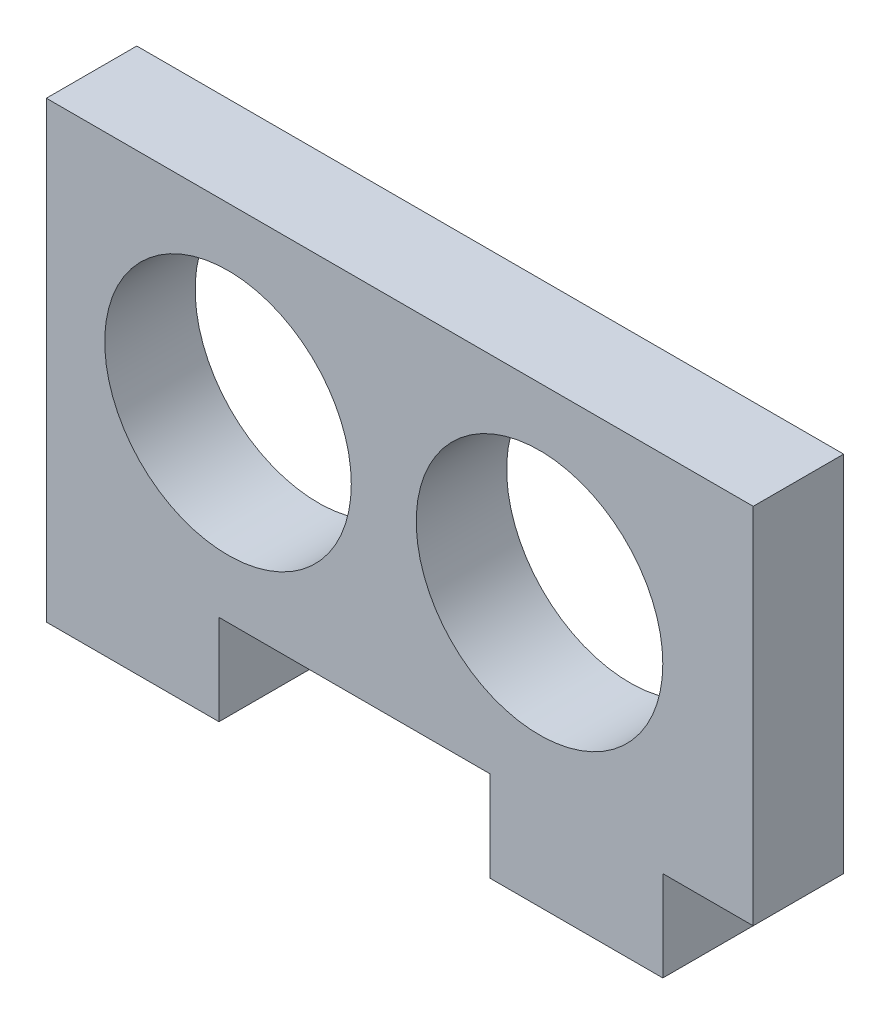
SolidWorks part; units mm, degrees
ref_plane "Front Plane" through (0, 0, 0) normal (0, 0, 1) x (1, 0, 0)
ref_plane "Top Plane" through (0, 0, 0) normal (0, 1, 0) x (1, 0, 0)
ref_plane "Right Plane" through (0, 0, 0) normal (1, 0, 0) x (0, 0, -1)
sketch "Sketch2" plane through (0, 0, 0) normal (0, 0, 1) x (1, 0, 0)
  line L0 (0, 0) -> (-37.3813, 0) construction
  line L1 (-37.3813, 0) -> (-37.3813, 5.5) construction
  line L2 (-37.3813, 5.5) -> (-0.0007, 5.5) construction
  line L4 (-37.3813, 5.5) -> (-37.3813, 27.6) construction
  line L5 (-37.3813, 27.6) -> (0.1187, 27.6) construction
  line L6 (0.1187, 27.6) -> (0.1187, 5.5) construction
  line L7 (0.1187, 5.5) -> (5.6187, 5.5) construction
  line L8 (5.6187, 5.5) -> (5.6187, 27.6) construction
  line L9 (5.6187, 27.6) -> (0.1187, 27.6) construction
  line L10 (-37.3813, 0) -> (-26.8813, 0) construction
  line L11 (0.1187, 27.6) -> (-14.8813, 27.6) construction
  line L12 (-37.3813, 27.6) -> (-15.2813, 27.6) construction
  line L13 (-15.2813, 27.6) -> (-15.2813, 5.5) construction
  line L14 (-14.8813, 27.6) -> (-14.8813, 5.5) construction
  line L15 (-14.8813, 16.55) -> (0.1187, 16.55) construction
  line L16 (-37.3813, 27.6) -> (-15.2813, 5.5) construction
  line L17 (-37.3813, 5.5) -> (-15.2813, 27.6) construction
  line L18 (-26.8813, 0) -> (-26.8813, 5.5) construction
  line L19 (0, 0) -> (-10.3813, 0) construction
  line L20 (-10.3813, 0) -> (-10.3813, 5.5) construction
  line L21 (-37.3813, 27.6) -> (0.1187, 27.6)
  line L22 (-37.3813, 27.6) -> (-37.3813, 0)
  line L23 (-37.3813, 0) -> (-26.8813, 0)
  line L24 (-26.8813, 0) -> (-26.8813, 5.5)
  line L25 (-26.8813, 5.5) -> (-10.3813, 5.5)
  line L26 (-10.3813, 5.5) -> (-10.3813, 0)
  line L27 (-10.3813, 0) -> (0, 0)
  line L29 (5.6187, 13.3165) -> (5.6187, 19.7835)
  line L31 (0.1187, 27.6) -> (5.6187, 27.6)
  line L32 (5.6187, 27.6) -> (5.6187, 19.7835)
  line L33 (5.6187, 13.3165) -> (5.6187, 5.5)
  line L34 (5.6187, 5.5) -> (0.1187, 5.5)
  line L37 (0.1187, 5.5) -> (0.1187, 0)
  line L38 (0.1187, 0) -> (0, 0)
  circle A1 centre (-7.3813, 16.55) radius 7.5
  circle A2 centre (-26.3313, 16.55) radius 7.5
  dimension "D2" = 5.5
  dimension "D3" = 15
  dimension "D1" = 15.4
extrude "Boss-Extrude1" add sketch "Sketch2" along normal blind 5.5
